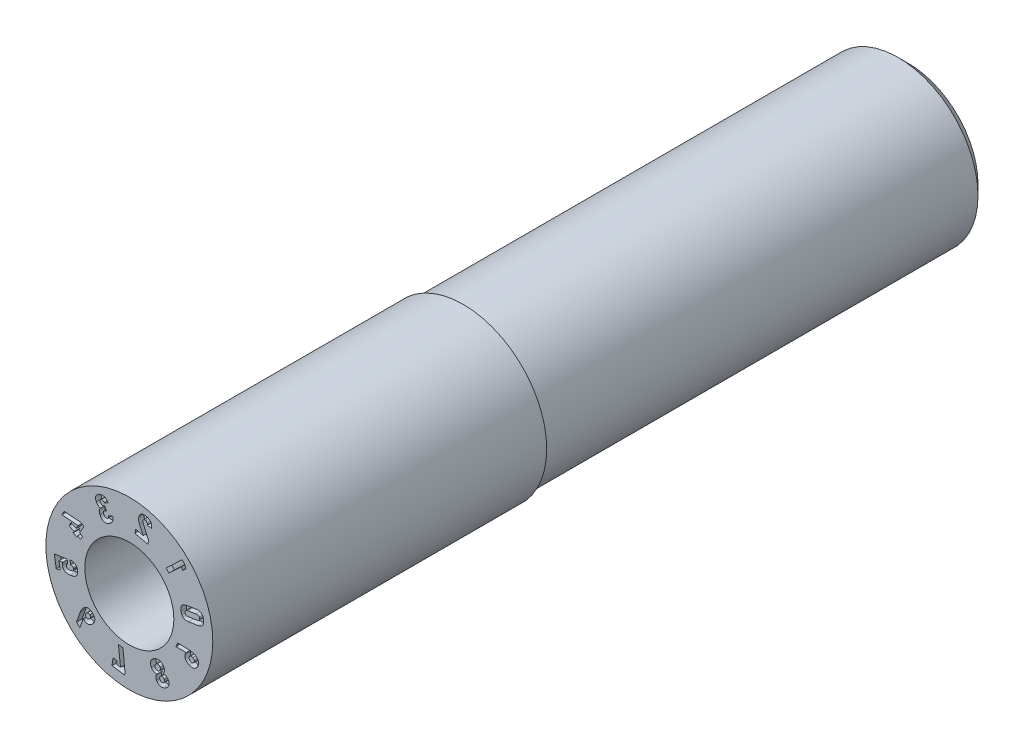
SolidWorks part; units mm, degrees
ref_plane "Front Plane" through (0, 0, 0) normal (0, 0, 1) x (1, 0, 0)
ref_plane "Top Plane" through (0, 0, 0) normal (0, 1, 0) x (1, 0, 0)
ref_plane "Right Plane" through (0, 0, 0) normal (1, 0, 0) x (0, 0, -1)
sketch "Sketch1" plane through (0, 0, 0) normal (1, 0, 0) x (0, 0, -1)
  line L2 (0, 1.5) -> (0, 0.8)
  line L3 (13.75, 1.5) -> (0, 1.5)
  line L4 (-3.7979, 0) -> (49996.2021, 0) construction
  line L8 (11, 0.6) -> (2.2, 0.6)
  line L9 (2.2, 0.8) -> (2.2, 0.6)
  line L10 (2.2, 0.8) -> (0, 0.8)
  line L12 (14, 1) -> (14, 1.25)
  line L16 (14, 1.25) -> (13.75, 1.5)
  line L17 (14, 1) -> (11, 1)
  line L18 (11, 0.6) -> (11, 1)
  dimension "D1" = 14
  dimension "D2" = 45
  dimension "D3" = 0.25
  dimension "D4" = 3
  dimension "D5" = 1.6
  dimension "D6" = 2.2
  dimension "D7" = 1.2
  dimension "D8" = 2
  dimension "D9" = 3
revolve "Revolve1" add sketch "Sketch1" angle 360 about L4
sketch "Sketch5" plane through (0, 0, 0) normal (1, 0, 0) x (0, 0, -1)
  line L0 (0, 0) -> (50000, 0) construction
  line L1 (0, 1.5) -> (0, -1.5) construction
  line L2 (6, 1.435) -> (14, 1.435)
  line L3 (6, 1.435) -> (6, 2.435)
  line L4 (6, 2.435) -> (14, 2.435)
  line L5 (14, 1.435) -> (14, 2.435)
  line L6 (14, -1.25) -> (14, 1.25) construction
  line L7 (13.75, 1.5) -> (0, 1.5) construction
  dimension "D1" = 6
  dimension "D2" = 0.065
  dimension "D3" = 1
revolve "Cut-Revolve1" cut sketch "Sketch5" angle 360 about L0
sketch "Sketch2" plane through (0, 0, 0) normal (0, 0, 1) x (1, 0, 0)
  line L0 (1.0611, 0.0913) -> (1.2413, 0.1208)
  line L1 (1.2024, 0.358) -> (1.0222, 0.3285)
  line L2 (1.0536, 0.2569) -> (1.1956, 0.2802)
  line L3 (1.21, 0.1924) -> (1.068, 0.1691)
  line L4 (0.6603, 0.7278) -> (0.7117, 0.6733)
  line L5 (0.7117, 0.6733) -> (0.937, 0.8857)
  line L6 (0.937, 0.8857) -> (0.9568, 0.838)
  line L7 (0.9568, 0.838) -> (1.0147, 0.8926)
  line L8 (1.0147, 0.8926) -> (0.9935, 0.9542)
  line L9 (0.9935, 0.9542) -> (0.9496, 1.0007)
  line L10 (0.9496, 1.0007) -> (0.6603, 0.7278)
  line L11 (0.3458, 0.999) -> (0.2537, 1.2059)
  line L12 (0.2459, 1.2577) -> (0.246, 1.2582)
  line L13 (0.3251, 1.2261) -> (0.3251, 1.2258)
  line L14 (0.3251, 1.2258) -> (0.4002, 1.2081)
  line L15 (0.4002, 1.2081) -> (0.4003, 1.2083)
  line L16 (0.1711, 1.2782) -> (0.171, 1.2778)
  line L17 (0.1826, 1.1698) -> (0.2499, 1.0264)
  line L18 (0.2499, 1.0264) -> (0.1169, 1.0577)
  line L19 (0.1169, 1.0577) -> (0.1003, 0.9872)
  line L20 (0.1003, 0.9872) -> (0.3302, 0.9329)
  line L21 (0.3302, 0.9329) -> (0.3458, 0.999)
  line L22 (-0.3008, 1.0561) -> (-0.3722, 1.0252)
  line L23 (-0.4546, 0.9968) -> (-0.4583, 1.0054)
  line L24 (-0.4437, 1.0637) -> (-0.4128, 1.0771)
  line L25 (-0.4128, 1.0771) -> (-0.4417, 1.1437)
  line L26 (-0.4417, 1.1437) -> (-0.4726, 1.1302)
  line L27 (-0.5165, 1.1561) -> (-0.5193, 1.1625)
  line L28 (-0.4492, 1.1866) -> (-0.3781, 1.2175)
  line L29 (-0.5966, 1.1373) -> (-0.5918, 1.1262)
  line L30 (-0.5302, 0.9679) -> (-0.5254, 0.9568)
  line L31 (-0.8764, 0.6719) -> (-1.1703, 0.6946)
  line L32 (-1.1703, 0.6946) -> (-1.2115, 0.6202)
  line L33 (-1.2115, 0.6202) -> (-0.9221, 0.5964)
  line L34 (-0.9221, 0.5964) -> (-0.9573, 0.5329)
  line L35 (-1.0089, 0.44) -> (-0.9456, 0.4048)
  line L36 (-0.9456, 0.4048) -> (-0.9305, 0.4321)
  line L37 (-0.816, 0.6384) -> (-0.8764, 0.6719)
  line L38 (-1.0455, 0.5818) -> (-1.082, 0.5162)
  line L39 (-1.082, 0.5162) -> (-0.9938, 0.4673)
  line L40 (-0.8768, 0.4024) -> (-0.8403, 0.468)
  line L41 (-0.8403, 0.468) -> (-0.894, 0.4978)
  line L42 (-1.066, -0.0061) -> (-1.0663, -0.0061)
  line L43 (-1.0663, -0.0061) -> (-1.0549, -0.0808)
  line L44 (-1.0549, -0.0808) -> (-1.0546, -0.0808)
  line L45 (-1.0449, -0.1648) -> (-1.0782, -0.1699)
  line L46 (-1.108, -0.0928) -> (-1.1186, -0.023)
  line L47 (-1.1186, -0.023) -> (-1.3465, -0.0577)
  line L48 (-1.3465, -0.0577) -> (-1.3142, -0.2706)
  line L49 (-1.3142, -0.2706) -> (-1.2422, -0.2596)
  line L50 (-1.2422, -0.2596) -> (-1.2632, -0.1214)
  line L51 (-1.2632, -0.1214) -> (-1.1932, -0.1107)
  line L52 (-1.0668, -0.2447) -> (-1.0335, -0.2396)
  line L53 (-0.827, -0.6395) -> (-0.8273, -0.6397)
  line L54 (-0.8851, -0.7381) -> (-0.948, -0.9179)
  line L55 (-0.948, -0.9179) -> (-0.8873, -0.9775)
  line L56 (-0.8873, -0.9775) -> (-0.8289, -0.8055)
  line L57 (-0.6614, -0.8047) -> (-0.6612, -0.8044)
  line L58 (-0.7116, -0.7483) -> (-0.7118, -0.7486)
  line L59 (-0.7711, -0.6899) -> (-0.7709, -0.6898)
  line L60 (-0.0777, -1.2625) -> (-0.1148, -0.9026)
  line L61 (-0.1148, -0.9026) -> (-0.1958, -0.8906)
  line L62 (-0.1958, -0.8906) -> (-0.1581, -1.2277)
  line L63 (-0.1581, -1.2277) -> (-0.2262, -1.2175)
  line L64 (-0.2262, -1.2175) -> (-0.2173, -1.1578)
  line L65 (-0.2173, -1.1578) -> (-0.2919, -1.1468)
  line L66 (-0.2919, -1.1468) -> (-0.3116, -1.2784)
  line L67 (-0.3116, -1.2784) -> (-0.0851, -1.3121)
  line L68 (-0.0851, -1.3121) -> (-0.0777, -1.2625)
  line L69 (0.3922, -0.9463) -> (0.3954, -0.952)
  line L70 (0.4863, -1.1021) -> (0.4914, -1.1113)
  line L71 (0.7002, -0.9977) -> (0.6951, -0.9885)
  line L72 (0.6187, -0.8306) -> (0.6155, -0.8248)
  line L73 (0.5544, -0.8707) -> (0.5562, -0.874)
  line L74 (0.4656, -0.923) -> (0.4636, -0.9194)
  line L75 (0.6273, -1.022) -> (0.6291, -1.0254)
  line L76 (0.553, -1.0665) -> (0.5511, -1.0629)
  line L77 (1.0719, -0.5718) -> (1.0721, -0.572)
  line L78 (1.1666, -0.3589) -> (1.1664, -0.3588)
  line L79 (1.0563, -0.3397) -> (0.8714, -0.3345)
  line L80 (0.8714, -0.3345) -> (0.8388, -0.4069)
  line L81 (0.8388, -0.4069) -> (1.0212, -0.409)
  line L82 (1.1388, -0.4286) -> (1.1391, -0.4288)
  line L83 (1.1047, -0.5043) -> (1.1044, -0.5042)
  line L84 (-0.9938, 0.4673) -> (-1.0089, 0.44)
  line L85 (-0.9573, 0.5329) -> (-1.0455, 0.5818)
  line L86 (-0.894, 0.4978) -> (-0.816, 0.6384)
  line L87 (-0.9305, 0.4321) -> (-0.8768, 0.4024)
  spline S0 degree 3 poles (0.9291, 0.1914) (0.9307, 0.1823) (0.9335, 0.1691) (0.9395, 0.1526) (0.9447, 0.1416) (0.9506, 0.1316) (0.9573, 0.1226) (0.9649, 0.1148) (0.9732, 0.1078) (0.9823, 0.1021) (0.9918, 0.0972) (1.0021, 0.0936) (1.0128, 0.0909) (1.0241, 0.0894) (1.0403, 0.0888) (1.0527, 0.09) (1.0611, 0.0913) knots 0 0 0 0 0.146858 0.214297 0.278678 0.33962 0.398795 0.456598 0.513449 0.570346 0.62688 0.683777 0.742279 0.802579 0.8651 1 1 1 1
  spline S1 degree 3 poles (1.2413, 0.1208) (1.2497, 0.1223) (1.262, 0.125) (1.2772, 0.1309) (1.2875, 0.136) (1.2969, 0.1419) (1.3053, 0.1487) (1.3128, 0.1563) (1.3194, 0.1648) (1.3251, 0.1739) (1.3296, 0.1839) (1.3332, 0.1945) (1.3356, 0.2059) (1.3369, 0.2179) (1.3374, 0.2354) (1.336, 0.2488) (1.3345, 0.2579) knots 0 0 0 0 0.135831 0.19895 0.259122 0.317792 0.374922 0.430943 0.487732 0.544477 0.602225 0.661405 0.722225 0.786186 0.853427 1 1 1 1
  spline S2 degree 3 poles (1.3345, 0.2579) (1.3331, 0.267) (1.33, 0.2802) (1.3241, 0.2967) (1.319, 0.3077) (1.313, 0.3177) (1.3064, 0.3267) (1.2989, 0.3346) (1.2906, 0.3415) (1.2818, 0.3474) (1.2721, 0.3521) (1.262, 0.3559) (1.2512, 0.3584) (1.2399, 0.3601) (1.2235, 0.3605) (1.2109, 0.3595) (1.2024, 0.358) knots 0 0 0 0 0.146618 0.21395 0.278189 0.339132 0.398087 0.455624 0.512166 0.568446 0.624592 0.681676 0.739861 0.800266 0.863502 1 1 1 1
  spline S3 degree 3 poles (1.0222, 0.3285) (1.0138, 0.327) (1.0015, 0.3243) (0.9863, 0.3184) (0.976, 0.3134) (0.9666, 0.3074) (0.9582, 0.3006) (0.9506, 0.293) (0.944, 0.2846) (0.9383, 0.2754) (0.9338, 0.2654) (0.9303, 0.2548) (0.928, 0.2434) (0.9266, 0.2314) (0.9263, 0.2139) (0.9276, 0.2005) (0.9291, 0.1914) knots 0 0 0 0 0.135782 0.198879 0.259458 0.317687 0.374796 0.431184 0.487953 0.544677 0.602405 0.661303 0.722473 0.78641 0.853479 1 1 1 1
  spline S4 degree 3 poles (1.0011, 0.2032) (1.0006, 0.2068) (1, 0.212) (1.0007, 0.2188) (1.0016, 0.2235) (1.0032, 0.2278) (1.0052, 0.232) (1.0078, 0.2357) (1.0121, 0.2404) (1.0189, 0.2456) (1.033, 0.2525) (1.045, 0.2557) (1.0536, 0.2569) knots 0 0 0 0 0.126013 0.183541 0.23858 0.292864 0.345382 0.398519 0.453086 0.568126 0.695113 1 1 1 1
  spline S5 degree 3 poles (1.1956, 0.2802) (1.2042, 0.2816) (1.2165, 0.2826) (1.232, 0.2805) (1.2401, 0.2778) (1.2457, 0.2748) (1.2494, 0.272) (1.2527, 0.2688) (1.2556, 0.2652) (1.2579, 0.261) (1.2608, 0.2548) (1.2618, 0.2496) (1.2625, 0.2461) knots 0 0 0 0 0.304005 0.431403 0.546128 0.600732 0.654117 0.707374 0.761014 0.81632 0.873767 1 1 1 1
  spline S6 degree 3 poles (1.2625, 0.2461) (1.263, 0.2426) (1.2636, 0.2373) (1.2629, 0.2305) (1.262, 0.2258) (1.2604, 0.2215) (1.2583, 0.2175) (1.2557, 0.2137) (1.2514, 0.209) (1.2446, 0.2038) (1.2306, 0.1968) (1.2186, 0.1937) (1.21, 0.1924) knots 0 0 0 0 0.125283 0.183773 0.2389 0.292522 0.345142 0.398364 0.45302 0.568245 0.695576 1 1 1 1
  spline S7 degree 3 poles (1.068, 0.1691) (1.0594, 0.1677) (1.047, 0.1668) (1.0315, 0.1688) (1.0234, 0.1716) (1.0178, 0.1747) (1.0142, 0.1774) (1.0109, 0.1806) (1.008, 0.1842) (1.0056, 0.1883) (1.0029, 0.1946) (1.0017, 0.1997) (1.0011, 0.2032) knots 0 0 0 0 0.305186 0.432689 0.548096 0.6021 0.655529 0.70798 0.761663 0.817203 0.87461 1 1 1 1
  spline S8 degree 3 poles (0.2537, 1.2059) (0.2498, 1.2146) (0.2461, 1.226) (0.2447, 1.2398) (0.2442, 1.248) (0.2451, 1.2539) (0.2459, 1.2577) knots 0 0 0 0 0.539847 0.665182 0.783746 1 1 1 1
  spline S9 degree 3 poles (0.246, 1.2582) (0.2472, 1.2628) (0.2497, 1.2698) (0.2563, 1.2766) (0.2619, 1.2804) (0.2686, 1.2828) (0.279, 1.2845) (0.2873, 1.283) (0.2928, 1.2819) knots 0 0 0 0 0.246554 0.35834 0.470644 0.586937 0.711616 1 1 1 1
  spline S10 degree 3 poles (0.2928, 1.2819) (0.2984, 1.2806) (0.3063, 1.2773) (0.3149, 1.2699) (0.3197, 1.2631) (0.3232, 1.2553) (0.3262, 1.2428) (0.326, 1.2329) (0.3251, 1.2261) knots 0 0 0 0 0.240642 0.353619 0.468242 0.587235 0.712494 1 1 1 1
  spline S11 degree 3 poles (0.4003, 1.2083) (0.4022, 1.2199) (0.4035, 1.2372) (0.4014, 1.2596) (0.3978, 1.2749) (0.3926, 1.2893) (0.3855, 1.3024) (0.3767, 1.3143) (0.3663, 1.3249) (0.3543, 1.3342) (0.3359, 1.3445) (0.3207, 1.3499) (0.31, 1.3523) knots 0 0 0 0 0.185769 0.271413 0.354359 0.434538 0.512194 0.589379 0.667038 0.746264 0.827541 1 1 1 1
  spline S12 degree 3 poles (0.31, 1.3523) (0.2988, 1.355) (0.282, 1.3577) (0.2601, 1.3574) (0.2452, 1.3555) (0.2314, 1.3517) (0.2188, 1.3462) (0.2073, 1.339) (0.1972, 1.3299) (0.1884, 1.3192) (0.1784, 1.3024) (0.1735, 1.2881) (0.1711, 1.2782) knots 0 0 0 0 0.194556 0.282839 0.366541 0.445965 0.522018 0.597071 0.672157 0.748899 0.828021 1 1 1 1
  spline S13 degree 3 poles (0.171, 1.2778) (0.169, 1.269) (0.167, 1.2554) (0.1668, 1.2371) (0.1676, 1.2231) (0.1698, 1.2093) (0.1738, 1.1912) (0.1787, 1.1782) (0.1826, 1.1698) knots 0 0 0 0 0.246194 0.370512 0.49772 0.624739 0.750482 1 1 1 1
  spline S14 degree 3 poles (-0.3738, 0.9024) (-0.3632, 0.907) (-0.3483, 0.9152) (-0.3309, 0.9289) (-0.3197, 0.94) (-0.3102, 0.9521) (-0.3027, 0.9651) (-0.297, 0.979) (-0.2934, 0.9936) (-0.2917, 1.0088) (-0.2928, 1.0301) (-0.2968, 1.0459) (-0.3008, 1.0561) knots 0 0 0 0 0.181387 0.266397 0.349196 0.429699 0.508011 0.586041 0.664911 0.744826 0.826381 1 1 1 1
  spline S15 degree 3 poles (-0.3722, 1.0252) (-0.3711, 1.0214) (-0.37, 1.0157) (-0.3699, 1.0082) (-0.3704, 1.0029) (-0.3716, 0.998) (-0.3733, 0.9933) (-0.3757, 0.989) (-0.3785, 0.985) (-0.3819, 0.9814) (-0.3873, 0.9769) (-0.392, 0.9743) (-0.3953, 0.9729) knots 0 0 0 0 0.187326 0.27311 0.355951 0.436293 0.514408 0.590459 0.668563 0.747272 0.827934 1 1 1 1
  spline S16 degree 3 poles (-0.3953, 0.9729) (-0.4013, 0.9704) (-0.4104, 0.9676) (-0.4225, 0.968) (-0.4306, 0.9703) (-0.4381, 0.9744) (-0.4472, 0.9826) (-0.4521, 0.9908) (-0.4546, 0.9968) knots 0 0 0 0 0.266705 0.38363 0.497524 0.612062 0.731013 1 1 1 1
  spline S17 degree 3 poles (-0.4583, 1.0054) (-0.4611, 1.0116) (-0.4641, 1.0209) (-0.465, 1.0333) (-0.464, 1.0414) (-0.4613, 1.0487) (-0.4553, 1.0572) (-0.4486, 1.0616) (-0.4437, 1.0637) knots 0 0 0 0 0.300449 0.427637 0.546364 0.656555 0.765559 1 1 1 1
  spline S18 degree 3 poles (-0.4726, 1.1302) (-0.4766, 1.1285) (-0.4831, 1.127) (-0.4916, 1.1285) (-0.4975, 1.1312) (-0.5031, 1.1355) (-0.5103, 1.1434) (-0.5143, 1.1508) (-0.5165, 1.1561) knots 0 0 0 0 0.227939 0.334435 0.446444 0.566137 0.696861 1 1 1 1
  spline S19 degree 3 poles (-0.5193, 1.1625) (-0.5215, 1.1675) (-0.5239, 1.1751) (-0.5242, 1.1853) (-0.523, 1.192) (-0.5203, 1.198) (-0.5148, 1.2053) (-0.5086, 1.209) (-0.5044, 1.2109) knots 0 0 0 0 0.287322 0.409765 0.527102 0.639753 0.75244 1 1 1 1
  spline S20 degree 3 poles (-0.5044, 1.2109) (-0.5013, 1.2122) (-0.4966, 1.2136) (-0.4901, 1.2141) (-0.4853, 1.2136) (-0.4804, 1.2126) (-0.4756, 1.2108) (-0.4708, 1.2084) (-0.4661, 1.2053) (-0.4616, 1.2015) (-0.4555, 1.1956) (-0.4517, 1.1903) (-0.4492, 1.1866) knots 0 0 0 0 0.149129 0.221829 0.295877 0.370819 0.449003 0.528923 0.614402 0.703669 0.796545 1 1 1 1
  spline S21 degree 3 poles (-0.3781, 1.2175) (-0.3836, 1.2277) (-0.3932, 1.2418) (-0.4086, 1.2579) (-0.4209, 1.2677) (-0.434, 1.2757) (-0.4477, 1.2817) (-0.4619, 1.2859) (-0.4765, 1.2879) (-0.4914, 1.2881) (-0.5117, 1.2857) (-0.5265, 1.2812) (-0.5361, 1.2769) knots 0 0 0 0 0.185488 0.271825 0.355694 0.437515 0.516845 0.594944 0.673718 0.753251 0.833269 1 1 1 1
  spline S22 degree 3 poles (-0.5361, 1.2769) (-0.5437, 1.2735) (-0.5547, 1.2681) (-0.568, 1.2592) (-0.5765, 1.2522) (-0.5842, 1.2448) (-0.5907, 1.2368) (-0.5962, 1.2284) (-0.6007, 1.2195) (-0.6041, 1.2102) (-0.6065, 1.2006) (-0.6076, 1.1907) (-0.6077, 1.1805) (-0.6066, 1.1701) (-0.6036, 1.1554) (-0.5997, 1.1445) (-0.5966, 1.1373) knots 0 0 0 0 0.145099 0.211783 0.275894 0.336683 0.396115 0.453924 0.511278 0.568019 0.624714 0.681957 0.740253 0.800965 0.864058 1 1 1 1
  spline S23 degree 3 poles (-0.5918, 1.1262) (-0.5883, 1.1182) (-0.5817, 1.1068) (-0.5697, 1.0946) (-0.5598, 1.0871) (-0.5488, 1.0813) (-0.5325, 1.0759) (-0.5196, 1.0745) (-0.5108, 1.075) knots 0 0 0 0 0.256823 0.378945 0.500019 0.621492 0.743176 1 1 1 1
  spline S24 degree 3 poles (-0.5108, 1.075) (-0.5146, 1.0721) (-0.5201, 1.0675) (-0.5261, 1.0604) (-0.53, 1.0549) (-0.5334, 1.049) (-0.5362, 1.0428) (-0.5382, 1.0362) (-0.5398, 1.0294) (-0.5408, 1.0224) (-0.5411, 1.0151) (-0.5409, 1.0076) (-0.54, 1) (-0.5385, 0.9922) (-0.5354, 0.9814) (-0.5325, 0.9733) (-0.5302, 0.9679) knots 0 0 0 0 0.121201 0.179079 0.236022 0.292614 0.350073 0.407952 0.466857 0.526625 0.588138 0.65092 0.715868 0.782358 0.851885 1 1 1 1
  spline S25 degree 3 poles (-0.5254, 0.9568) (-0.5211, 0.9469) (-0.5135, 0.9328) (-0.5001, 0.917) (-0.4893, 0.9073) (-0.4776, 0.8996) (-0.4649, 0.8938) (-0.4513, 0.8903) (-0.437, 0.8886) (-0.422, 0.889) (-0.4004, 0.8924) (-0.3844, 0.8979) (-0.3738, 0.9024) knots 0 0 0 0 0.178074 0.259615 0.337969 0.413848 0.489007 0.56467 0.643009 0.724526 0.810719 1 1 1 1
  spline S26 degree 3 poles (-0.9298, -0.1042) (-0.9312, -0.094) (-0.9353, -0.0792) (-0.944, -0.061) (-0.9522, -0.0488) (-0.9619, -0.0378) (-0.9731, -0.0283) (-0.9857, -0.0203) (-0.9997, -0.0139) (-1.0148, -0.0091) (-1.037, -0.0052) (-1.0543, -0.005) (-1.066, -0.0061) knots 0 0 0 0 0.165215 0.244127 0.322749 0.400604 0.478371 0.557853 0.639635 0.724164 0.81171 1 1 1 1
  spline S27 degree 3 poles (-1.0546, -0.0808) (-1.0479, -0.0805) (-1.0381, -0.0809) (-1.0261, -0.0847) (-1.0186, -0.0887) (-1.0122, -0.094) (-1.0054, -0.1027) (-1.0029, -0.1108) (-1.0021, -0.1164) knots 0 0 0 0 0.285793 0.412921 0.532398 0.647956 0.76037 1 1 1 1
  spline S28 degree 3 poles (-1.0021, -0.1164) (-1.0011, -0.1222) (-1.0011, -0.1312) (-1.0054, -0.142) (-1.0102, -0.1489) (-1.0166, -0.1548) (-1.028, -0.1612) (-1.0379, -0.1639) (-1.0449, -0.1648) knots 0 0 0 0 0.244926 0.356384 0.468897 0.585752 0.710067 1 1 1 1
  spline S29 degree 3 poles (-1.0782, -0.1699) (-1.0851, -0.1711) (-1.0953, -0.1716) (-1.108, -0.1693) (-1.1158, -0.1661) (-1.1224, -0.1616) (-1.1291, -0.1535) (-1.1319, -0.1459) (-1.1326, -0.1406) knots 0 0 0 0 0.303139 0.433057 0.551453 0.66201 0.769651 1 1 1 1
  spline S30 degree 3 poles (-1.1326, -0.1406) (-1.1333, -0.1356) (-1.1337, -0.128) (-1.1314, -0.1184) (-1.1288, -0.1118) (-1.125, -0.1059) (-1.1185, -0.0989) (-1.1124, -0.0949) (-1.108, -0.0928) knots 0 0 0 0 0.263149 0.38542 0.50731 0.62704 0.747387 1 1 1 1
  spline S31 degree 3 poles (-1.1932, -0.1107) (-1.1955, -0.1142) (-1.1985, -0.12) (-1.2012, -0.1286) (-1.2043, -0.143) (-1.2044, -0.1557) (-1.2029, -0.1655) knots 0 0 0 0 0.22051 0.343083 0.473506 1 1 1 1
  spline S32 degree 3 poles (-1.2029, -0.1655) (-1.2015, -0.1752) (-1.1977, -0.189) (-1.1891, -0.2056) (-1.181, -0.2163) (-1.1715, -0.2255) (-1.1604, -0.2331) (-1.1479, -0.2392) (-1.134, -0.2436) (-1.1189, -0.2465) (-1.0962, -0.2479) (-1.0787, -0.2466) (-1.0668, -0.2447) knots 0 0 0 0 0.163456 0.239144 0.313392 0.387378 0.461556 0.538434 0.619394 0.70541 0.797084 1 1 1 1
  spline S33 degree 3 poles (-1.0335, -0.2396) (-1.0216, -0.2377) (-1.0043, -0.2338) (-0.9835, -0.2244) (-0.9699, -0.2162) (-0.9582, -0.2066) (-0.9482, -0.1956) (-0.9402, -0.1833) (-0.9341, -0.1696) (-0.9298, -0.1548) (-0.9269, -0.1328) (-0.928, -0.1157) (-0.9298, -0.1042) knots 0 0 0 0 0.186829 0.271959 0.353046 0.43114 0.506366 0.581642 0.658196 0.737162 0.819376 1 1 1 1
  spline S34 degree 3 poles (-0.6592, -0.6353) (-0.6673, -0.6273) (-0.6803, -0.6165) (-0.6995, -0.6062) (-0.7138, -0.6009) (-0.7282, -0.5977) (-0.7428, -0.5969) (-0.7573, -0.5984) (-0.7718, -0.6023) (-0.7862, -0.6083) (-0.8055, -0.6197) (-0.8188, -0.6309) (-0.827, -0.6395) knots 0 0 0 0 0.1801 0.262678 0.341899 0.418651 0.494011 0.569864 0.647645 0.728527 0.813594 1 1 1 1
  spline S35 degree 3 poles (-0.8273, -0.6397) (-0.8324, -0.6451) (-0.84, -0.6536) (-0.8491, -0.6661) (-0.863, -0.6869) (-0.8723, -0.7059) (-0.8789, -0.7216) knots 0 0 0 0 0.230217 0.350353 0.475606 1 1 1 1
  spline S36 degree 3 poles (-0.8789, -0.7216) (-0.8799, -0.7244) (-0.8824, -0.7298) (-0.8842, -0.7354) (-0.8851, -0.7381) knots 0 0 0 0 0.511009 1 1 1 1
  spline S37 degree 3 poles (-0.8289, -0.8055) (-0.8261, -0.8095) (-0.8229, -0.8133) (-0.8194, -0.8167) knots 0.757127 0.757127 0.757127 0.757127 1 1 1 1
  spline S38 degree 3 poles (-0.8194, -0.8167) (-0.8121, -0.824) (-0.8003, -0.8335) (-0.7827, -0.8423) (-0.7695, -0.8466) (-0.7561, -0.8488) (-0.7425, -0.8488) (-0.7288, -0.8466) (-0.715, -0.8423) (-0.7012, -0.8359) (-0.6825, -0.8242) (-0.6696, -0.8131) (-0.6614, -0.8047) knots 0 0 0 0 0.171794 0.250452 0.32671 0.401751 0.476551 0.552959 0.632715 0.716337 0.804953 1 1 1 1
  spline S39 degree 3 poles (-0.6612, -0.8044) (-0.6528, -0.7959) (-0.6416, -0.7824) (-0.6303, -0.7627) (-0.6245, -0.7481) (-0.6207, -0.7334) (-0.6195, -0.7187) (-0.6203, -0.7041) (-0.6237, -0.6897) (-0.6292, -0.6755) (-0.6399, -0.6563) (-0.6509, -0.6434) (-0.6592, -0.6353) knots 0 0 0 0 0.186782 0.272276 0.353205 0.431351 0.50723 0.582334 0.658568 0.737552 0.81966 1 1 1 1
  spline S40 degree 3 poles (-0.71, -0.6871) (-0.7058, -0.6913) (-0.7001, -0.6983) (-0.6966, -0.7092) (-0.6958, -0.7172) (-0.6971, -0.7252) (-0.7012, -0.7365) (-0.7072, -0.7437) (-0.7116, -0.7483) knots 0 0 0 0 0.26046 0.375583 0.489396 0.604448 0.723759 1 1 1 1
  spline S41 degree 3 poles (-0.7118, -0.7486) (-0.717, -0.7538) (-0.7251, -0.7607) (-0.7374, -0.7664) (-0.7461, -0.7684) (-0.7547, -0.7684) (-0.7661, -0.7655) (-0.7734, -0.7602) (-0.7777, -0.7559) knots 0 0 0 0 0.293773 0.419015 0.536353 0.648012 0.758189 1 1 1 1
  spline S42 degree 3 poles (-0.7777, -0.7559) (-0.782, -0.7518) (-0.7873, -0.7445) (-0.7903, -0.7332) (-0.7904, -0.7246) (-0.7884, -0.7158) (-0.783, -0.7034) (-0.7761, -0.6952) (-0.7711, -0.6899) knots 0 0 0 0 0.239544 0.349077 0.46198 0.580211 0.706534 1 1 1 1
  spline S43 degree 3 poles (-0.7709, -0.6898) (-0.7664, -0.6852) (-0.7591, -0.6793) (-0.7481, -0.6747) (-0.7401, -0.6735) (-0.7321, -0.6741) (-0.7213, -0.6775) (-0.7143, -0.683) (-0.71, -0.6871) knots 0 0 0 0 0.278665 0.398236 0.513422 0.626906 0.742285 1 1 1 1
  spline S44 degree 3 poles (0.4506, -0.7876) (0.4401, -0.7933) (0.4254, -0.8031) (0.4087, -0.8189) (0.3984, -0.8314) (0.39, -0.8446) (0.3837, -0.8583) (0.3798, -0.8726) (0.3777, -0.8873) (0.378, -0.9022) (0.3812, -0.9225) (0.3873, -0.937) (0.3922, -0.9463) knots 0 0 0 0 0.188838 0.276574 0.36158 0.443446 0.522304 0.599442 0.677093 0.754953 0.833863 1 1 1 1
  spline S45 degree 3 poles (0.3954, -0.952) (0.4001, -0.9607) (0.409, -0.9727) (0.4241, -0.9858) (0.4368, -0.9941) (0.4505, -1.0007) (0.4697, -1.0069) (0.4848, -1.0083) (0.4948, -1.0078) knots 0 0 0 0 0.246725 0.370361 0.498167 0.62566 0.750333 1 1 1 1
  spline S46 degree 3 poles (0.4948, -1.0078) (0.4898, -1.0148) (0.4836, -1.0261) (0.4789, -1.0424) (0.4769, -1.055) (0.4766, -1.0675) (0.4783, -1.0837) (0.4826, -1.0951) (0.4863, -1.1021) knots 0 0 0 0 0.257519 0.383851 0.511706 0.638422 0.759949 1 1 1 1
  spline S47 degree 3 poles (0.4914, -1.1113) (0.496, -1.12) (0.5046, -1.1321) (0.5188, -1.1452) (0.5305, -1.1531) (0.5432, -1.159) (0.5565, -1.1633) (0.5706, -1.1654) (0.5852, -1.1657) (0.6002, -1.1639) (0.6211, -1.159) (0.6362, -1.1523) (0.6461, -1.147) knots 0 0 0 0 0.166668 0.245791 0.324267 0.402014 0.479594 0.558615 0.640144 0.724432 0.811865 1 1 1 1
  spline S48 degree 3 poles (0.6461, -1.147) (0.6559, -1.1416) (0.6697, -1.1325) (0.6852, -1.1177) (0.6949, -1.106) (0.7026, -1.0936) (0.7084, -1.0806) (0.7121, -1.0672) (0.714, -1.0534) (0.7137, -1.0393) (0.7104, -1.0202) (0.705, -1.0064) (0.7002, -0.9977) knots 0 0 0 0 0.188212 0.275462 0.360001 0.441724 0.5203 0.597693 0.675491 0.753736 0.832898 1 1 1 1
  spline S49 degree 3 poles (0.6951, -0.9885) (0.6913, -0.9814) (0.6838, -0.9717) (0.6712, -0.9611) (0.6603, -0.9547) (0.6487, -0.9496) (0.6322, -0.945) (0.6193, -0.9442) (0.6108, -0.9447) knots 0 0 0 0 0.242008 0.364042 0.490138 0.617931 0.743949 1 1 1 1
  spline S50 degree 3 poles (0.6108, -0.9447) (0.6166, -0.9365) (0.6236, -0.9229) (0.6292, -0.9034) (0.6312, -0.8883) (0.6313, -0.8731) (0.6286, -0.8533) (0.6235, -0.8392) (0.6187, -0.8306) knots 0 0 0 0 0.251613 0.376293 0.50415 0.63115 0.75456 1 1 1 1
  spline S51 degree 3 poles (0.6155, -0.8248) (0.6104, -0.8157) (0.6016, -0.8027) (0.5863, -0.7889) (0.574, -0.7806) (0.5605, -0.7743) (0.5463, -0.7699) (0.5314, -0.7677) (0.5158, -0.7675) (0.4997, -0.7694) (0.4773, -0.7747) (0.4612, -0.782) (0.4506, -0.7876) knots 0 0 0 0 0.166154 0.244773 0.322772 0.400586 0.477635 0.556648 0.63809 0.723022 0.810912 1 1 1 1
  spline S52 degree 3 poles (0.4854, -0.8516) (0.4896, -0.8493) (0.4962, -0.8465) (0.5053, -0.8446) (0.5119, -0.8441) (0.5185, -0.8443) (0.5247, -0.8458) (0.5308, -0.8477) (0.5365, -0.8508) (0.5418, -0.8546) (0.5482, -0.8609) (0.5523, -0.8665) (0.5544, -0.8707) knots 0 0 0 0 0.179208 0.262954 0.345963 0.426694 0.505835 0.58415 0.664429 0.744497 0.827079 1 1 1 1
  spline S53 degree 3 poles (0.5562, -0.874) (0.5583, -0.8777) (0.5606, -0.8836) (0.562, -0.8918) (0.5621, -0.8979) (0.5613, -0.9038) (0.5595, -0.9096) (0.5571, -0.9152) (0.5536, -0.9206) (0.5495, -0.9256) (0.5428, -0.932) (0.5368, -0.9359) (0.5326, -0.9383) knots 0 0 0 0 0.16632 0.244989 0.322776 0.400909 0.477959 0.557301 0.638801 0.724004 0.811028 1 1 1 1
  spline S54 degree 3 poles (0.5326, -0.9383) (0.5283, -0.9406) (0.5218, -0.9435) (0.5127, -0.9456) (0.5062, -0.9464) (0.4999, -0.9463) (0.4938, -0.9453) (0.488, -0.9435) (0.4826, -0.941) (0.4775, -0.9376) (0.4713, -0.932) (0.4677, -0.9267) (0.4656, -0.923) knots 0 0 0 0 0.188698 0.275243 0.359936 0.441905 0.521279 0.598082 0.675813 0.753887 0.832974 1 1 1 1
  spline S55 degree 3 poles (0.4636, -0.9194) (0.4615, -0.9153) (0.4587, -0.909) (0.4572, -0.9001) (0.4568, -0.8936) (0.4574, -0.8873) (0.459, -0.8812) (0.4613, -0.8752) (0.4646, -0.8697) (0.4687, -0.8644) (0.4752, -0.8578) (0.4812, -0.8539) (0.4854, -0.8516) knots 0 0 0 0 0.173442 0.255555 0.335791 0.41502 0.493572 0.572433 0.652914 0.735681 0.819937 1 1 1 1
  spline S56 degree 3 poles (0.5676, -1.0027) (0.5712, -1.0008) (0.5768, -0.9984) (0.5846, -0.997) (0.5903, -0.9967) (0.5958, -0.9972) (0.6012, -0.9985) (0.6064, -1.0006) (0.6113, -1.0035) (0.616, -1.0071) (0.6217, -1.013) (0.6253, -1.0182) (0.6273, -1.022) knots 0 0 0 0 0.174105 0.256518 0.335896 0.413794 0.490764 0.569486 0.6503 0.733636 0.81871 1 1 1 1
  spline S57 degree 3 poles (0.6291, -1.0254) (0.631, -1.0289) (0.6334, -1.0343) (0.6348, -1.0419) (0.6352, -1.0474) (0.6348, -1.0528) (0.6336, -1.058) (0.6316, -1.063) (0.6289, -1.0677) (0.6256, -1.0722) (0.6199, -1.0777) (0.6149, -1.0811) (0.6113, -1.0831) knots 0 0 0 0 0.175695 0.258711 0.3392 0.417969 0.495637 0.573857 0.653052 0.734718 0.819292 1 1 1 1
  spline S58 degree 3 poles (0.6113, -1.0831) (0.6077, -1.085) (0.6022, -1.0875) (0.5945, -1.089) (0.5889, -1.0895) (0.5835, -1.0892) (0.5782, -1.0881) (0.5732, -1.0862) (0.5684, -1.0836) (0.5639, -1.0803) (0.5583, -1.075) (0.5549, -1.07) (0.553, -1.0665) knots 0 0 0 0 0.179686 0.263223 0.344127 0.423754 0.501973 0.580147 0.659128 0.740409 0.82302 1 1 1 1
  spline S59 degree 3 poles (0.5511, -1.0629) (0.549, -1.0592) (0.5466, -1.0535) (0.5449, -1.0455) (0.5445, -1.0397) (0.5447, -1.0341) (0.5458, -1.0286) (0.5476, -1.0233) (0.5502, -1.0185) (0.5535, -1.0138) (0.5591, -1.0082) (0.564, -1.0046) (0.5676, -1.0027) knots 0 0 0 0 0.179693 0.263435 0.346335 0.426986 0.505681 0.583403 0.662663 0.742852 0.824598 1 1 1 1
  spline S60 degree 3 poles (1.0212, -0.409) (1.021, -0.4093) (1.019, -0.4116) (1.0135, -0.4187) (1.0094, -0.4264) (1.007, -0.4318) knots 0.564286 0.564286 0.564286 0.564286 0.581374 0.712937 1 1 1 1
  spline S61 degree 3 poles (1.007, -0.4318) (1.0031, -0.4405) (0.9987, -0.454) (0.9971, -0.4725) (0.998, -0.486) (1.0009, -0.4992) (1.0058, -0.5119) (1.0124, -0.5241) (1.0211, -0.5354) (1.0313, -0.5462) (1.0478, -0.5594) (1.0618, -0.5674) (1.0719, -0.5718) knots 0 0 0 0 0.164632 0.242706 0.320408 0.397788 0.475088 0.554519 0.636518 0.722073 0.810187 1 1 1 1
  spline S62 degree 3 poles (1.0721, -0.572) (1.083, -0.5768) (1.0996, -0.5828) (1.122, -0.5865) (1.1377, -0.5869) (1.1527, -0.5852) (1.1669, -0.5815) (1.1801, -0.5755) (1.1925, -0.5675) (1.204, -0.5575) (1.2181, -0.5408) (1.2265, -0.5261) (1.2312, -0.5156) knots 0 0 0 0 0.187679 0.273085 0.354256 0.432048 0.50805 0.582768 0.659259 0.73786 0.819816 1 1 1 1
  spline S63 degree 3 poles (1.2312, -0.5156) (1.2359, -0.5052) (1.2413, -0.4893) (1.2443, -0.4677) (1.2441, -0.4525) (1.2419, -0.4378) (1.2374, -0.4238) (1.2306, -0.4107) (1.2219, -0.3983) (1.2109, -0.3869) (1.1932, -0.3725) (1.1777, -0.3639) (1.1666, -0.3589) knots 0 0 0 0 0.177917 0.259849 0.338518 0.414863 0.490141 0.565827 0.644192 0.725963 0.811371 1 1 1 1
  spline S64 degree 3 poles (1.1664, -0.3588) (1.16, -0.356) (1.15, -0.3522) (1.1359, -0.3486) (1.1245, -0.3461) (1.1124, -0.3442) (1.095, -0.342) (1.0816, -0.341) (1.0724, -0.3405) knots 0 0 0 0 0.21643 0.332453 0.453551 0.580519 0.713715 1 1 1 1
  spline S65 degree 3 poles (1.0724, -0.3405) (1.0698, -0.3403) (1.0644, -0.3398) (1.059, -0.3398) (1.0563, -0.3397) knots 0 0 0 0 0.499822 1 1 1 1
  spline S66 degree 3 poles (1.0773, -0.4462) (1.0797, -0.4408) (1.0846, -0.4334) (1.0938, -0.4266) (1.1015, -0.4234) (1.11, -0.422) (1.1228, -0.4226) (1.1324, -0.4258) (1.1388, -0.4286) knots 0 0 0 0 0.24586 0.357748 0.470577 0.587379 0.711576 1 1 1 1
  spline S67 degree 3 poles (1.1391, -0.4288) (1.1451, -0.4316) (1.1536, -0.4364) (1.1622, -0.4454) (1.1665, -0.4526) (1.1689, -0.4604) (1.1696, -0.4718) (1.1672, -0.4803) (1.1647, -0.4856) knots 0 0 0 0 0.284239 0.406222 0.522183 0.635478 0.748679 1 1 1 1
  spline S68 degree 3 poles (1.1647, -0.4856) (1.1622, -0.4911) (1.1576, -0.4988) (1.1484, -0.5058) (1.1409, -0.5091) (1.1326, -0.5107) (1.1201, -0.5102) (1.1108, -0.507) (1.1047, -0.5043) knots 0 0 0 0 0.253208 0.366338 0.478812 0.595326 0.717102 1 1 1 1
  spline S69 degree 3 poles (1.1044, -0.5042) (1.098, -0.5014) (1.0894, -0.4963) (1.0804, -0.4871) (1.0759, -0.4798) (1.0733, -0.4719) (1.0724, -0.4603) (1.0748, -0.4517) (1.0773, -0.4462) knots 0 0 0 0 0.286746 0.410303 0.526567 0.638733 0.750983 1 1 1 1
extrude "Cut-Extrude1" cut sketch "Sketch2" against normal blind 0.1
sketch "Sketch3" plane through (0, 0, -2.2) normal (0, 0, 1) x (1, 0, 0)
  line L0 (0, 0) -> (0, 50000) construction
  line L1 (0.3464, 0.6) -> (-0.3464, 0.6)
  line L2 (-0.3464, 0.6) -> (-0.6928, 0)
  line L3 (-0.6928, 0) -> (-0.3464, -0.6)
  line L4 (-0.3464, -0.6) -> (0.3464, -0.6)
  line L5 (0.3464, -0.6) -> (0.6928, 0)
  line L6 (0.6928, 0) -> (0.3464, 0.6)
  line L7 (0, 0) -> (50000, 0) construction
  circle A0 centre (0, 0) radius 0.6 construction
  circle A1 centre (0, 0) radius 0.6 construction
extrude "Cut-Extrude2" cut sketch "Sketch3" against normal blind 1.4
